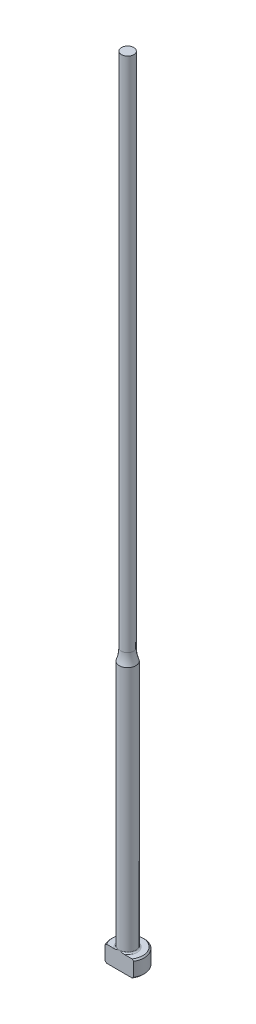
SolidWorks part; units mm, degrees
ref_plane "Front Plane" through (0, 0, 0) normal (0, 0, 1) x (1, 0, 0)
ref_plane "Top Plane" through (0, 0, 0) normal (0, 1, 0) x (1, 0, 0)
ref_plane "Right Plane" through (0, 0, 0) normal (1, 0, 0) x (0, 0, -1)
sketch "Sketch1" plane through (0, 0, 0) normal (0, 0, 1) x (1, 0, 0)
  line L0 (0, 259.9588) -> (0, -15.1925) construction
  line L1 (0, 0) -> (-3.175, 0)
  line L2 (-3.175, 0) -> (-3.175, 3.175)
  line L3 (-3.175, 3.175) -> (-1.5875, 3.175)
  line L4 (-1.19, 53.0114) -> (-1.19, 152.4)
  line L5 (-1.19, 152.4) -> (0, 152.4)
  line L6 (0, 152.4) -> (0, 0)
  line L7 (-1.5875, 3.175) -> (-1.5875, 50.8)
  arc A0 (-1.5875, 50.8) -> (-1.19, 53.0114) centre (-7.54, 53.0114) ccw
  point P13 (-1.5875, 0)
  dimension "D1" = 6.35
  dimension "L" = 152.4
  dimension "D2" = 3.175
  dimension "H" = 6.35
  dimension "T" = 3.175
  dimension "D" = 2.38
  dimension "S" = 50.8
revolve "Revolve1" add sketch "Sketch1" angle 360 about L0
chamfer "Chamfer1" distance 0.254 angle 45 2 edges at (0, 3.175, 3.175) (0, 0, 3.175)
fillet "Fillet1" radius 0.254 1 edges at (0, 3.175, 1.5875)
sketch "Sketch2" plane through (0, 0, 0) normal (0, -1, 0) x (1, 0, 0)
  line L0 (-2.7496, 1.5875) -> (2.7496, 1.5875)
  circle A0 centre (0, 0) radius 3.175 construction
  arc A1 (2.7496, 1.5875) -> (-2.7496, 1.5875) centre (0, 0) ccw
  circle A4 centre (0, 0) radius 1.5875 construction
  dimension "D1" = 0
extrude "KEY" cut sketch "Sketch2" against normal through all
